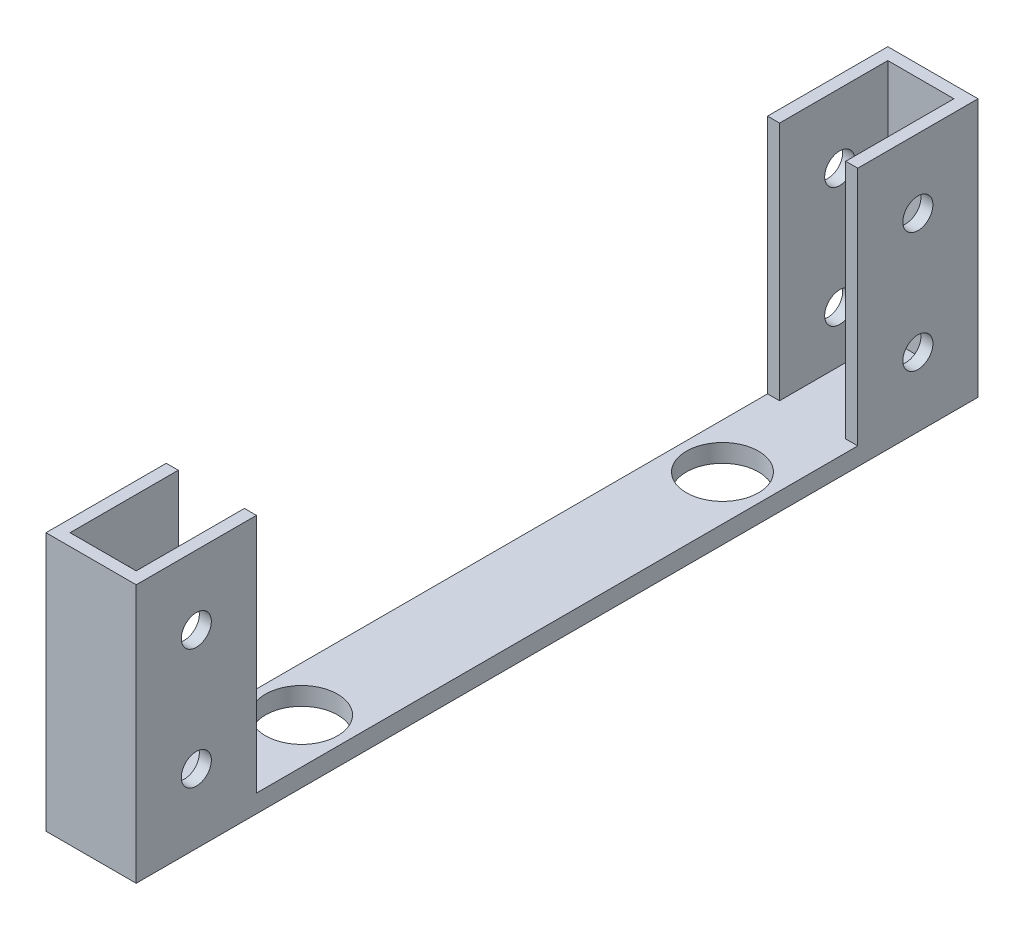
SolidWorks part; units mm, degrees
ref_plane "Alzado" through (0, 0, 0) normal (0, 0, 1) x (1, 0, 0)
ref_plane "Planta" through (0, 0, 0) normal (0, 1, 0) x (1, 0, 0)
ref_plane "Vista lateral" through (0, 0, 0) normal (1, 0, 0) x (0, 0, -1)
sketch "Croquis1" plane through (0, 0, 0) normal (0, 1, 0) x (1, 0, 0)
  line L1 (7.5, -70) -> (-7.5, -70)
  line L2 (7.5, -70) -> (7.5, 70)
  line L3 (7.5, 70) -> (-7.5, 70)
  line L4 (-7.5, -70) -> (-7.5, 70)
  line L5 (7.5, -70) -> (-7.5, 70) construction
  line L6 (7.5, 70) -> (-7.5, -70) construction
  point P0 (0, 0)
extrude "Saliente-Extruir2" add sketch "Croquis1" along normal blind 3
sketch "Croquis3" plane through (0, 3, 0) normal (0, 1, 0) x (1, 0, 0)
  line L0 (0, 70) -> (0, 35) construction
  line L1 (7.5, 70) -> (-7.5, 70) construction
  line L2 (0, 35) -> (0, -35) construction
  circle A0 centre (0, -35) radius 6
  circle A1 centre (0, 35) radius 6
extrude "Cortar-Extruir1" cut sketch "Croquis3" against normal blind 3
sketch "Croquis4" plane through (0, 3, 0) normal (0, 1, 0) x (1, 0, 0)
  line L0 (-7.5, 70) -> (-5.5, 70) construction
  line L1 (-7.5, 70) -> (7.5, 70)
  line L2 (-7.5, 70) -> (-7.5, 50)
  line L3 (-7.5, -70) -> (7.5, -70)
  line L4 (7.5, 70) -> (7.5, 50)
  line L5 (-5.5, 70) -> (-5.5, 68) construction
  line L6 (7.5, -70) -> (5.5, -70) construction
  line L7 (5.5, -70) -> (5.5, -68) construction
  line L8 (5.5, 70) -> (5.5, 50) construction
  line L9 (5.5, -68) -> (-5.5, -68)
  line L10 (5.5, -68) -> (5.5, -50)
  line L11 (5.5, 68) -> (-5.5, 68)
  line L12 (-5.5, -68) -> (-5.5, -50)
  line L13 (5.5, 50) -> (7.5, 50)
  line L14 (-5.5, 50) -> (-7.5, 50)
  line L15 (5.5, -70) -> (5.5, -50) construction
  line L16 (5.5, -50) -> (7.5, -50)
  line L17 (-5.5, -50) -> (-7.5, -50)
  line L18 (-7.5, -50) -> (-7.5, -70)
  line L19 (-5.5, 50) -> (-5.5, 68)
  line L20 (5.5, 50) -> (5.5, 68)
  line L21 (7.5, -50) -> (7.5, -70)
extrude "Saliente-Extruir3" add sketch "Croquis4" along normal blind 40
sketch "Croquis5" plane through (7.5, 0, 0) normal (1, 0, 0) x (0, 0, -1)
  line L0 (-70, 21.5) -> (-50, 21.5) construction
  line L3 (-70, 43) -> (-70, 0) construction
  line L4 (-50, 43) -> (-50, 3) construction
  line L5 (70, 21.5) -> (50, 21.5) construction
  line L6 (70, 43) -> (70, 0) construction
  line L7 (50, 43) -> (50, 3) construction
  line L8 (-60, 21.5) -> (-60, 11.5) construction
  line L9 (-60, 21.5) -> (-60, 31.5) construction
  line L10 (60, 21.5) -> (60, 11.5) construction
  line L11 (60, 21.5) -> (60, 31.5) construction
  circle A0 centre (-60, 31.5) radius 2.5
  circle A1 centre (-60, 11.5) radius 2.5
  circle A2 centre (60, 31.5) radius 2.5
  circle A3 centre (60, 11.5) radius 2.5
extrude "Cortar-Extruir2" cut sketch "Croquis5" against normal blind 15
